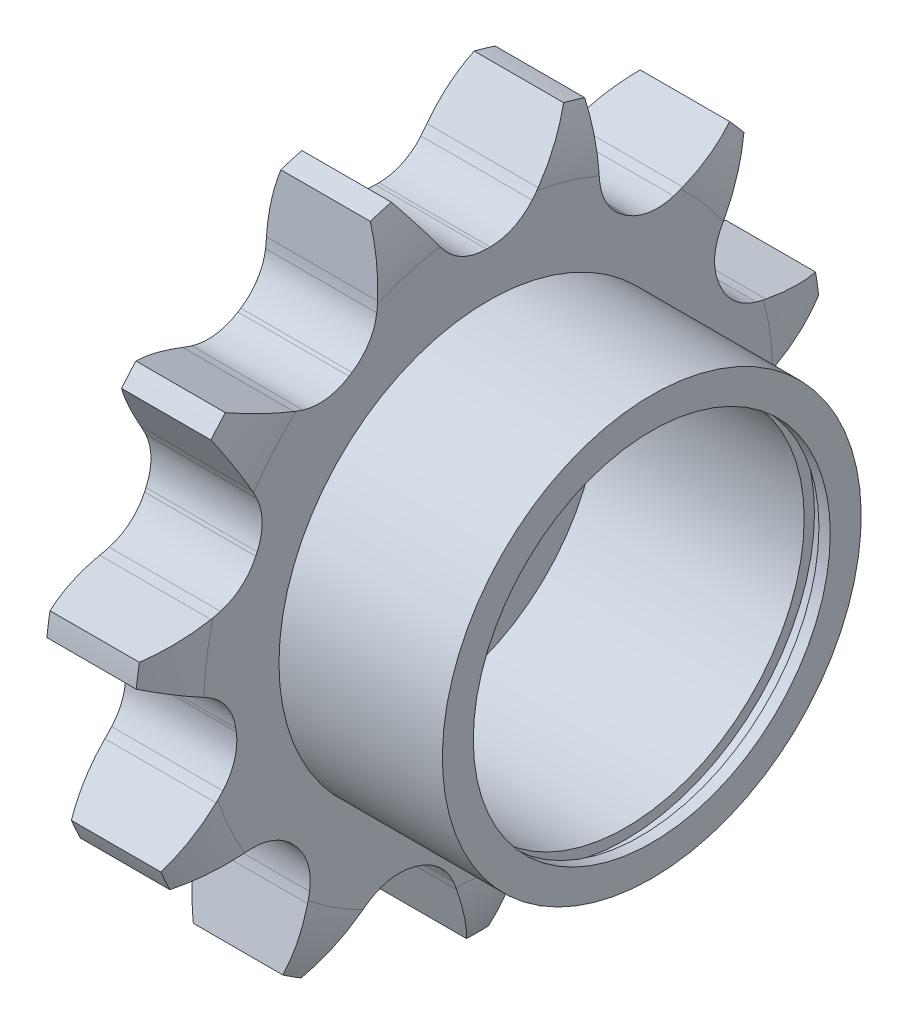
SolidWorks part; units mm, degrees
ref_plane "Front" through (0, 0, 0) normal (0, 0, 1) x (1, 0, 0)
ref_plane "Top" through (0, 0, 0) normal (0, 1, 0) x (1, 0, 0)
ref_plane "Right" through (0, 0, 0) normal (1, 0, 0) x (0, 0, -1)
imported_body "2116-11"
sketch "Esquisse1" plane through (0, 0, 0) normal (0, 1, 0) x (1, 0, 0)
  line L0 (40, 0) -> (40, 26)
  line L1 (16.2, 0) -> (40, 0) construction
  line L2 (40, -30.5) -> (40, 30.5) construction
  line L3 (40, 26) -> (38.35, 26)
  line L4 (38.35, 26) -> (38.35, 27.5)
  line L5 (38.35, 27.5) -> (36.2, 27.5)
  line L6 (36.2, 27.5) -> (36.2, 26)
  line L7 (36.2, 26) -> (6.2, 26)
  line L9 (6.2, 26) -> (6.2, 0)
  line L14 (6.2, 0) -> (40, 0)
  dimension "D1" = 26
  dimension "D2" = 27.5
  dimension "D3" = 33.8
  dimension "D4" = 1.65
  dimension "D5" = 2.15
revolve "Enlèvement de matière-Révolution1" cut sketch "Esquisse1" angle 360
sketch "Esquisse2" plane through (0, 0, 0) normal (-1, 0, 0) x (0, 0, 1)
  circle A0 centre (0, 0) radius 17.5
  dimension "D1" = 35
extrude "Enlèv. mat.-Extru.1" cut sketch "Esquisse2" against normal through all
